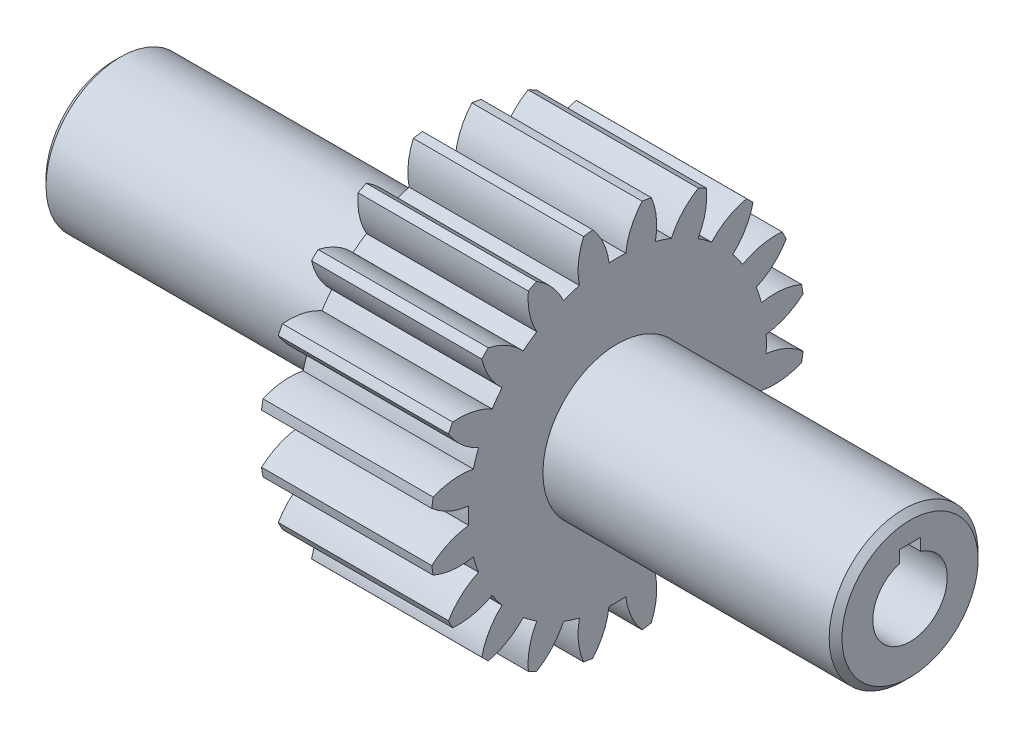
SolidWorks part; units mm, degrees
ref_plane "Plane1" through (0, 0, 0) normal (0, 0, 1) x (1, 0, 0)
ref_plane "Plane2" through (0, 0, 0) normal (0, 1, 0) x (1, 0, 0)
ref_plane "Plane3" through (0, 0, 0) normal (1, 0, 0) x (0, 0, -1)
sketch "HoldingSke" plane through (0, 0, 0) normal (0, 1, 0) x (1, 0, 0)
  line L0 (0, 0) -> (0.1175, -0.0428)
  line L1 (-15, 0) -> (100, 0) construction
  line L2 (0, 0) -> (-2.1039, 2.3779)
  line L3 (0, 0) -> (-11.863, 4.5341)
  line L4 (0, 0) -> (8.1152, 2.9537)
  line L5 (0, 0) -> (-46.8476, -17.4728)
  line L6 (0, 0) -> (-66.317, -44.7443)
  line L7 (-2.1039, 2.3779) -> (15.1161, 80.5027)
  line L8 (-76.2, 54.61) -> (-71.3, 54.61)
  line L9 (-71.009, 38.7566) -> (-53.1078, 45.2721)
  line L10 (-76.2, 71.12) -> (104.1128, 71.12)
  line L11 (0, 0) -> (-80, 0)
  line L12 (-76.2, 101.6) -> (-75.945, 101.6)
  line L13 (24.9733, 27.94) -> (52.9518, 28.4284)
  line L14 (24.9733, 27.94) -> (24.9743, 27.94)
  line L15 (24.9733, 27.94) -> (100.4006, 29.5858)
  line L16 (-63.627, -8) -> (-12.827, -8)
  circle A0 centre (0, 0) radius 35
  circle A1 centre (0, 0) radius 37.5
  circle A2 centre (0, 0) radius 37.5
  circle A3 centre (0, 0) radius 35
  dimension "MHD" = 75
  dimension "Hub_dia" = 75
  dimension "Bore" = 70
  dimension "MBD" = 70
  dimension "Num_teeth" = 20
  dimension "Pitch_radius" = 180.3128
  dimension "Pitch" = 0.125
  dimension "Width" = 80
  dimension "Overall_len" = 50
  dimension "Show_teeth" = 20
  dimension "Thickness" = 80
  dimension "OAL" = 80.0001
  dimension "T_dim" = 4.9
  dimension "Ap" = 20
  dimension "H" = 19.05
  dimension "Backlash" = 0.255
  dimension "Addendum_fac" = 1
  dimension "Dedendum_fac" = 1.25
  dimension "Clearance_fac" = 0.25
  dimension "Dedendum_add" = 0.001
  dimension "Module" = 8
sketch "BasProSke" plane through (0, 0, 0) normal (0, 1, 0) x (1, 0, 0)
  line L0 (-10, 0) -> (60, 0) construction
  line L1 (0, 0) -> (0, 88)
  line L2 (0, 0) -> (80, 0)
  line L3 (80, 0) -> (80, 88)
  line L4 (80, 88) -> (0, 88)
  dimension "Diameter" = 176
  dimension "Thickness" = 80
revolve "Base-Revolve" add sketch "BasProSke" angle 360 about L0
sketch "TooCutSke" plane through (0, 0, 0) normal (1, 0, 0) x (0, 0, -1)
  line L1 (0, 0) -> (0, 107) construction
  line L2 (0, 0) -> (-6.7228, 79.717) construction
  line L3 (0, 0) -> (-24.963, 157.6099) construction
  line L4 (-6.7228, 79.717) -> (-12.4815, 78.8049) construction
  arc A0 (3.9251, 69.8889) -> (-3.9251, 69.8889) centre (0, 0) ccw
  arc A1 (11.646, 87.2516) -> (-11.646, 87.2516) centre (0, 0) ccw
  circle A2 centre (0, 0) radius 80 construction
  circle A3 centre (0, 0) radius 75.1754 construction
  arc A4 (-3.9251, 69.8889) -> (-11.646, 87.2516) centre (-35.7064, 66.1543) ccw
  arc A5 (11.646, 87.2516) -> (3.9251, 69.8889) centre (35.7064, 66.1543) ccw
  dimension "Root_dia" = 139.998
  dimension "Overcut_dia" = 176.0508
  dimension "Pitch_dia" = 160
  dimension "Base_dia" = 150.3508
  dimension "Flank_rad" = 32
  dimension "Half_ang" = 9
  dimension "Half_CT" = 5.8305
extrude "ToothCut" cut sketch "TooCutSke" along normal through all
fillet "Breaks" [suppressed] radius 0.16
fillet "RootFillets" [suppressed] radius 2.001
pattern_circular "TeethCuts" count 20 every 18 about axis through (-10, 0, 0) along (1, 0, 0) of "ToothCut", "RootFillets", "Breaks"
sketch "HubNeaOneSke" plane through (0, 0, 0) normal (-1, 0, 0) x (0, 0, 1)
  circle A0 centre (0, 0) radius 37.5
  dimension "Diameter" = 75
extrude "HubNearOne" [suppressed] add sketch "HubNeaOneSke" along normal blind 12.7001
sketch "HubNeaBotSke" plane through (0, 0, 0) normal (-1, 0, 0) x (0, 0, 1)
  circle A0 centre (0, 0) radius 37.5
  dimension "Diameter" = 75
extrude "HubNearBoth" [suppressed] add sketch "HubNeaBotSke" along normal blind 6.35
ref_plane "FarPln" through (80, 0, 0) normal (1, 0, 0) x (0, 0, -1)
sketch "HubFarSke" plane through (80, 0, 0) normal (1, 0, 0) x (0, 0, -1)
  circle A0 centre (0, 0) radius 37.5
  dimension "Diameter" = 75
extrude "HubFar" [suppressed] add sketch "HubFarSke" along normal blind 6.35
sketch "BorSke" plane through (0, 0, 0) normal (1, 0, 0) x (0, 0, -1)
  circle A0 centre (0, 0) radius 35
  dimension "Diameter" = 70
extrude "Bore" cut sketch "BorSke" along normal mid plane 160.0001
sketch "KeySke" plane through (0, 0, 0) normal (1, 0, 0) x (0, 0, -1)
  line L0 (-10, 0) -> (-10, 39.9)
  line L1 (-10, 39.9) -> (10, 39.9)
  line L2 (10, 39.9) -> (10, 0)
  line L3 (0, 0) -> (0, 34) construction
  line L4 (-10, 0) -> (10, 0)
  dimension "Offset" = 39.9
  dimension "Width" = 20
extrude "Keyway" [suppressed] cut sketch "KeySke" along normal mid plane 160.0001
pattern_circular "Keyway2" [suppressed] count 2 every 90 about axis through (-10, 0, 0) along (1, 0, 0)
sketch "Esquisse4" plane through (80, 0, 0) normal (1, 0, 0) x (0, 0, -1)
  line L1 (0, 0) -> (0, 45) construction
  line L4 (-5, 16.7705) -> (-5, 22.5)
  line L6 (-5, 22.5) -> (5, 22.5)
  line L7 (5, 16.7705) -> (5, 22.5)
  circle A0 centre (0, 0) radius 35 construction
  circle A1 centre (0, 0) radius 17.5 construction
  circle A2 centre (0, 0) radius 35
  arc A3 (-5, 16.7705) -> (5, 16.7705) centre (0, 0) ccw
  point P4 (0, 22.5)
  dimension "D1" = 10
  dimension "D2" = 22.5
extrude "Boss.-Extru.3" add sketch "Esquisse4" along normal up to surface (137.5 mm away) and the other way up to surface (236.5 mm away) separate body
chamfer "Chanfrein1" distance 3 angle 45 2 edges at (-156.5, 0, -35) (217.5, 0, -35)
equation "' \"Module@HoldingSke\" = 6.35"
equation "' \"Num_teeth@HoldingSke\" = 12"
equation "' \"Ap@HoldingSke\" =  20"
equation "' \"Width@HoldingSke\" = 0.5 * 25.4"
equation "' \"Hub_dia@HoldingSke\"= 1 * 25.4"
equation "' \"Overall_len@HoldingSke\" = 1.0 * 25.4"
equation "' \"Bore@HoldingSke\" = 0.75 * 25.4"
equation "' \"T_dim@HoldingSke\" = 0.1 * 25.4"
equation "' \"Width@KeySke\" = 0.25 * 25.4"
equation "' \"Show_teeth@HoldingSke\" = 13"
equation "' \"Backlash@HoldingSke\" = 0.009 * 25.4"
equation "' \"Addendum_fac@HoldingSke\" = 1.0"
equation "' \"Dedendum_fac@HoldingSke\" = 1.25"
equation "' \"Dedendum_add@HoldingSke\" = 0.00005 * 25.4"
equation "' \"Clearance_fac@HoldingSke\" = 0.25"
equation "\"Pitch@HoldingSke\" = 1 / \"Module@HoldingSke\""
equation "\"Overcut_dia@TooCutSke\" = (\"Num_teeth@HoldingSke\" + 2 * \"Addendum_fac@HoldingSke\") / \"Pitch@HoldingSke\" + 0.002 * 25.4"
equation "\"Pitch_dia@TooCutSke\" = \"Num_teeth@HoldingSke\" / \"Pitch@HoldingSke\""
equation "\"Base_dia@TooCutSke\" = \"Num_teeth@HoldingSke\" / \"Pitch@HoldingSke\" * cos((\"Ap@HoldingSke\"  * 3.14159265 / 180))"
equation "\"Root_dia@TooCutSke\" = (\"Num_teeth@HoldingSke\" + 2) / \"Pitch@HoldingSke\" - 2 * (\"Addendum_fac@HoldingSke\" + \"Dedendum_fac@HoldingSke\") / \"Pitch@HoldingSke\" - \"Dedendum_add@HoldingSke\" * 2"
equation "\"Half_ang@TooCutSke\" = 180 / \"Num_teeth@HoldingSke\""
equation "\"Half_CT@TooCutSke\" = \"Num_teeth@HoldingSke\" / \"Pitch@HoldingSke\" * sin((3.14159265 / 2 / \"Num_teeth@HoldingSke\")) / 2 - 7 * \"Backlash@HoldingSke\" / 4"
equation "\"Flank_rad@TooCutSke\" = \"Num_teeth@HoldingSke\" / \"Pitch@HoldingSke\" / 5"
equation "\"Radius@RootFillets\" = \"Clearance_fac@HoldingSke\" / \"Pitch@HoldingSke\" + \"Dedendum_add@HoldingSke\""
equation "\"Break_rad@Breaks\" = 0.02 / \"Pitch@HoldingSke\""
equation "\"Thickness@HoldingSke\" = \"Width@HoldingSke\""
equation "\"OAL@HoldingSke\" = \"Thickness@HoldingSke\""
equation "\"MHD@HoldingSke\" = (\"Num_teeth@HoldingSke\" + 2) / \"Pitch@HoldingSke\" - 2 * (\"Addendum_fac@HoldingSke\" + \"Dedendum_fac@HoldingSke\")  / \"Pitch@HoldingSke\" - \"Dedendum_add@HoldingSke\" * 2"
equation "\"MBD@HoldingSke\" = (\"Num_teeth@HoldingSke\" + 2) / \"Pitch@HoldingSke\" - 2 * (\"Addendum_fac@HoldingSke\" + \"Dedendum_fac@HoldingSke\")  / \"Pitch@HoldingSke\" - \"Dedendum_add@HoldingSke\" * 2 - 0.002 * 25.4"
equation "\"MHD@HoldingSke\" = ((sgn( \"MHD@HoldingSke\" - \"Hub_dia@HoldingSke\" )-1)*( \"MHD@HoldingSke\" - \"Hub_dia@HoldingSke\" ))/-2+ \"Hub_dia@HoldingSke\""
equation "\"MBD@HoldingSke\" = ((sgn( \"MBD@HoldingSke\" - \"Bore@HoldingSke\" )-1)*( \"MBD@HoldingSke\" - \"Bore@HoldingSke\" ))/-2+ \"Bore@HoldingSke\""
equation "\"OAL@HoldingSke\" = ((sgn( \"OAL@HoldingSke\" - \"Overall_len@HoldingSke\" )+1)*( \"OAL@HoldingSke\" - \"Overall_len@HoldingSke\" ))/2 + \"Overall_len@HoldingSke\" + 0.000002 * 25.4"
equation "\"Num_teeth@TeethCuts\" = int( \"Show_teeth@HoldingSke\" ) + 1"
equation "\"Num_teeth@TeethCuts\" = ((sgn( \"Num_teeth@TeethCuts\" - \"Num_teeth@HoldingSke\" )-1)*( \"Num_teeth@TeethCuts\" - \"Num_teeth@HoldingSke\" ))/-2+ \"Num_teeth@HoldingSke\""
equation "\"Num_teeth@TeethCuts\" = ((sgn( \"Num_teeth@TeethCuts\" - 2.0)+1)*( \"Num_teeth@TeethCuts\" - 2.0))/2 +2.0"
equation "\"Angle@TeethCuts\" = 360.0 / \"Num_teeth@HoldingSke\""
equation "\"Diameter@BasProSke\" = (\"Num_teeth@HoldingSke\" + 2 * \"Addendum_fac@HoldingSke\") / \"Pitch@HoldingSke\""
equation "\"Thickness@BasProSke\"  = \"Thickness@HoldingSke\""
equation "' \"Fillet_rad@BasProSke\" =  \"Thickness@HoldingSke\" * 0.05"
equation "\"MHD@HoldingSke\" = ((sgn( \"MHD@HoldingSke\" - \"Root_dia@TooCutSke\" )-1)*( \"MHD@HoldingSke\" - \"Root_dia@TooCutSke\" ))/-2+ \"Root_dia@TooCutSke\""
equation "\"Diameter@HubNeaOneSke\" = \"MHD@HoldingSke\""
equation "\"Length@HubNearOne\" = \"OAL@HoldingSke\" - \"Thickness@BasProSke\""
equation "\"Diameter@HubNeaBotSke\" = \"MHD@HoldingSke\""
equation "\"Length@HubNearBoth\" = ( \"OAL@HoldingSke\" - \"Thickness@BasProSke\" ) / 2.0"
equation "\"Thickness@FarPln\" = \"Thickness@BasProSke\""
equation "\"Diameter@HubFarSke\" = \"MHD@HoldingSke\""
equation "\"Length@HubFar\" = ( \"OAL@HoldingSke\" - \"Thickness@BasProSke\" ) / 2.0"
equation "\"Diameter@BorSke\" = \"MBD@HoldingSke\""
equation "\"D1@Bore\" = \"OAL@HoldingSke\" * 2.0"
equation "\"D1@Keyway\" = \"OAL@HoldingSke\" * 2.0"
equation "\"Offset@KeySke\" = \"T_dim@HoldingSke\" + \"MBD@HoldingSke\" / 2.0"
